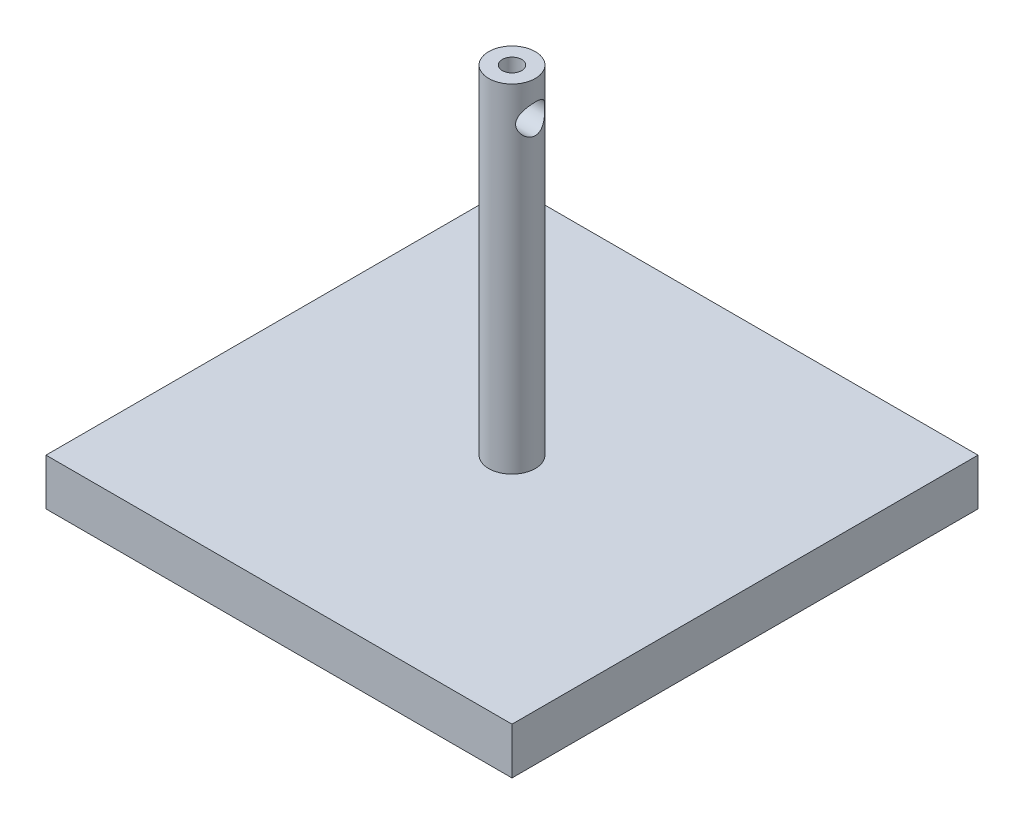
SolidWorks part; units mm, degrees
ref_plane "Front Plane" through (0, 0, 0) normal (0, 0, 1) x (1, 0, 0)
ref_plane "Top Plane" through (0, 0, 0) normal (0, 1, 0) x (1, 0, 0)
ref_plane "Right Plane" through (0, 0, 0) normal (1, 0, 0) x (0, 0, -1)
sketch "Sketch1" plane through (0, 0, 0) normal (0, 1, 0) x (1, 0, 0)
  line L1 (-25.4, -25.4) -> (25.4, -25.4)
  line L2 (-25.4, -25.4) -> (-25.4, 25.4)
  line L3 (-25.4, 25.4) -> (25.4, 25.4)
  line L4 (25.4, -25.4) -> (25.4, 25.4)
  line L5 (-25.4, -25.4) -> (25.4, 25.4) construction
  line L6 (-25.4, 25.4) -> (25.4, -25.4) construction
  point P0 (0, 0)
  dimension "D1" = 50.8
  dimension "D2" = 50.8
extrude "Boss-Extrude1" add sketch "Sketch1" along normal blind 5.08
sketch "Sketch2" plane through (0, 5.08, 0) normal (0, 1, 0) x (1, 0, 0)
  circle A0 centre (0, 0) radius 2.54
  dimension "D1" = 5.08
extrude "Boss-Extrude2" add sketch "Sketch2" along normal blind 36.83
sketch "Sketch3" plane through (0, 0, 0) normal (1, 0, 0) x (0, 0, -1)
  line L0 (0, 41.91) -> (0, 38.1) construction
  line L1 (2.54, 41.91) -> (-2.54, 41.91) construction
  circle A0 centre (0, 38.1) radius 1.5875
  dimension "D2" = 3.175
  dimension "D1" = 3.81
extrude "Cut-Extrude1" cut sketch "Sketch3" against normal through all both and the other way through all
sketch "Sketch4" plane through (0, 41.91, 0) normal (0, 1, 0) x (1, 0, 0)
  circle A0 centre (0, 0) radius 1.0583
  dimension "D1" = 2.1167
extrude "Cut-Extrude2" cut sketch "Sketch4" against normal up to next
sketch "Sketch6" plane through (0, 0, 0) normal (0, -1, 0) x (1, 0, 0)
  circle A0 centre (0, 0) radius 4.064
  dimension "D1" = 8.128
extrude "Cut-Extrude4" cut sketch "Sketch6" against normal blind 2.54
